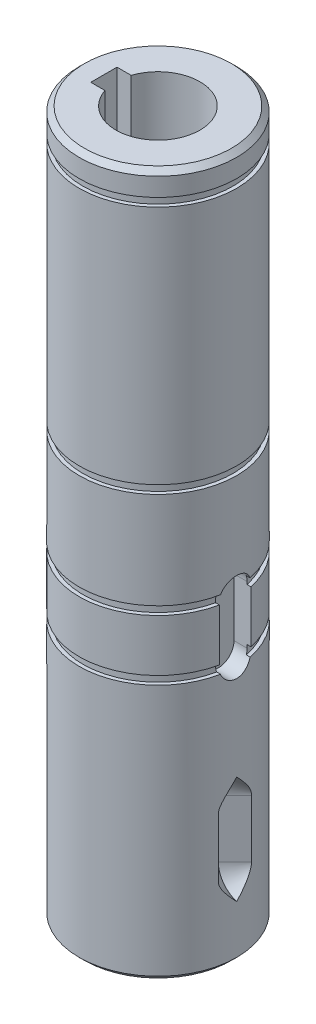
SolidWorks part; units mm, degrees
ref_plane "Face" through (0, 0, 0) normal (0, 0, 1) x (1, 0, 0)
ref_plane "Dessus" through (0, 0, 0) normal (0, 1, 0) x (1, 0, 0)
ref_plane "Droite" through (0, 0, 0) normal (1, 0, 0) x (0, 0, -1)
sketch "Esquisse1" plane through (0, 0, 0) normal (0, 0, 1) x (1, 0, 0)
  line L0 (0, 0) -> (0, -105.1992) construction
  line L1 (8, 0) -> (8, -134)
  line L2 (8, -134) -> (15, -134)
  line L3 (15, -134) -> (15, -84.98)
  line L4 (15, 0) -> (8, 0)
  line L5 (15, -4.5) -> (14.3, -4.5)
  line L6 (14.3, -4.5) -> (14.3, -6.1)
  line L7 (14.3, -6.1) -> (15, -6.1)
  line L8 (15, -4.5) -> (15, 0)
  line L9 (15, -71.88) -> (14.3, -71.88)
  line L10 (14.3, -71.88) -> (14.3, -73.48)
  line L11 (14.3, -73.48) -> (15, -73.48)
  line L12 (15, -83.38) -> (14.3, -83.38)
  line L13 (14.3, -83.38) -> (14.3, -84.98)
  line L14 (14.3, -84.98) -> (15, -84.98)
  line L15 (15, -83.38) -> (15, -73.48)
  line L16 (15, -71.88) -> (15, -53.5)
  line L17 (15, -51.9) -> (14.3, -51.9)
  line L18 (14.3, -51.9) -> (14.3, -53.5)
  line L19 (14.3, -53.5) -> (15, -53.5)
  line L20 (15, -51.9) -> (15, -6.1)
  dimension "D1" = 134
  dimension "D2" = 16
  dimension "D3" = 30
  dimension "D4" = 4.5
  dimension "D5" = 1.6
  dimension "D6" = 28.6
  dimension "D7" = 19.98
  dimension "D8" = 11.5
  dimension "D9" = 49
revolve "Base-Révolution" add sketch "Esquisse1" angle 360 about L0
sketch "Esquisse7" plane through (0, -134, 0) normal (0, -1, 0) x (1, 0, 0)
  circle A0 centre (0, 0) radius 11
  dimension "D1" = 22
sketch "Esquisse2" plane through (0, 0, 0) normal (0, 1, 0) x (-1, 0, 0)
  line L0 (18.0382, 0) -> (0, 0) construction
  line L1 (4.2352, -2.5) -> (4.2352, 2.5)
  line L2 (4.2352, 2.5) -> (10.3, 2.5)
  line L3 (10.3, -2.5) -> (10.3, 2.5)
  line L4 (4.2352, -2.5) -> (10.3, -2.5)
  circle A1 centre (0, 0) radius 8 construction
  dimension "D1" = 2.5
  dimension "D2" = 10.3
extrude "Enlèv. mat.-Extru.2" cut sketch "Esquisse2" against normal up to next
ref_plane "Plan1" through (11.5, 0, 0) normal (1, 0, 0) x (0, 0, -1)
sketch "Esquisse6" plane through (11.5, 0, 0) normal (1, 0, 0) x (0, 0, -1)
  line L0 (0, 13.3801) -> (0, -122.0377) construction
  line L1 (3, -72.98) -> (3, -83.98)
  line L3 (-3, -72.98) -> (-3, -83.98)
  arc A0 (3, -83.98) -> (-3, -83.98) centre (0, -83.98) cw
  arc A1 (3, -72.98) -> (-3, -72.98) centre (0, -72.98) ccw
  dimension "D2" = 11
  dimension "D3" = 72.98
  dimension "D1" = 6
extrude "Enlèv. mat.-Extru.4" cut sketch "Esquisse6" along normal blind 10
chamfer "Chanfrein1" distance 1 angle 45 2 edges at (0, 0, 15) (0, -134, 15)
extrude "Enlèv. mat.-Extru.5" cut sketch "Esquisse7" against normal blind 105
ref_plane "Plan2" through (0, -119, 0) normal (0, -1, 0) x (1, 0, 0)
sketch "Esquisse8" plane through (0, -119, 0) normal (0, -1, 0) x (1, 0, 0)
  line L0 (0, 0) -> (17.4504, 0) construction
  line L1 (11.5, 0) -> (21.5, 10)
  line L2 (11.5, 0) -> (21.5, -10)
  line L3 (21.5, 10) -> (21.5, -10)
  dimension "D1" = 90
  dimension "D2" = 11.5
  dimension "D3" = 10
extrude "Enlèv. mat.-Extru.6" cut sketch "Esquisse8" against normal blind 11
sketch "Esquisse9" plane through (0, -108, 0) normal (0, -1, 0) x (1, 0, 0)
  line L0 (11.5, 0) -> (14.6628, -3.1628) construction
  line L1 (11.5, 0) -> (16.5, -5)
  line L2 (16.5, 11.1196) -> (16.5, -18.5881) construction
  line L3 (14.6628, 3.1628) -> (11.5, 0) construction
  line L4 (16.5, 5) -> (11.5, 0)
  line L5 (16.5, 5) -> (16.5, -5)
  dimension "D1" = 5
revolve "Enlèvement de matière-Révolution2" cut sketch "Esquisse9" angle 360 about L2
sketch "Esquisse10" plane through (0, -119, 0) normal (0, 1, 0) x (-1, 0, 0)
  line L0 (-16.5, 11.1196) -> (-16.5, -18.5881) construction
  line L1 (-16.5, 11.1196) -> (-16.5, -18.5881) construction
  line L3 (-16.5, -5) -> (-11.5, 0)
  line L4 (-16.5, 5) -> (-16.5, -5)
  line L5 (-11.5, 0) -> (-16.5, 5)
  line L6 (-16.5, -5) -> (-11.5, 0)
  line L7 (-16.5, 5) -> (-16.5, -5)
  line L8 (-11.5, 0) -> (-16.5, 5)
  dimension "D1" = 0
revolve "Enlèvement de matière-Révolution3" cut sketch "Esquisse10" angle 360 about L1
